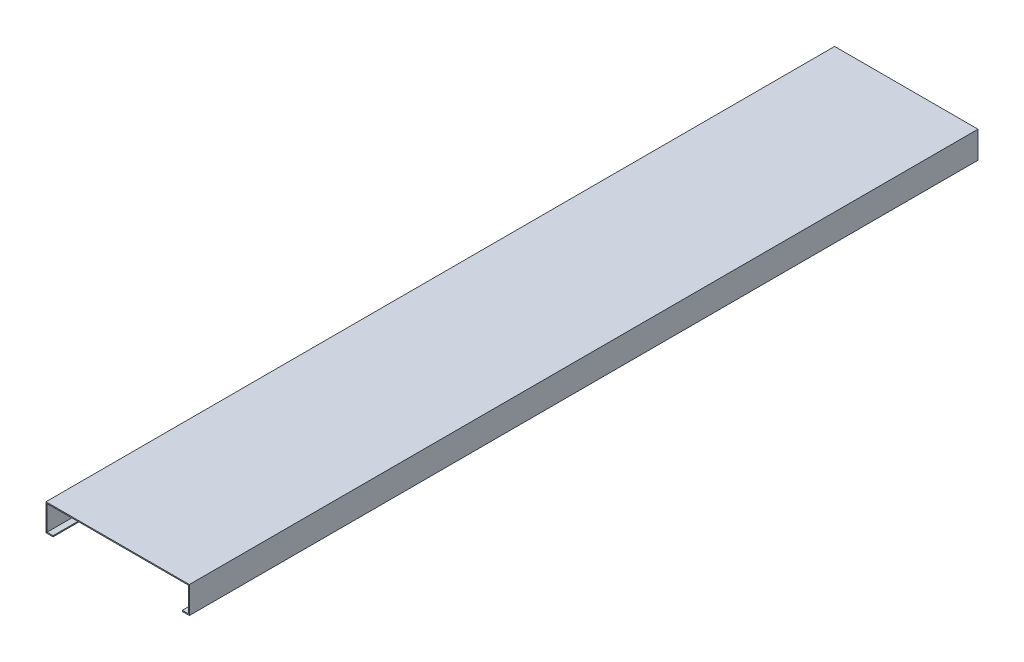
SolidWorks part; units mm, degrees
ref_plane "Alzado" through (0, 0, 0) normal (0, 0, 1) x (1, 0, 0)
ref_plane "Planta" through (0, 0, 0) normal (0, 1, 0) x (1, 0, 0)
ref_plane "Vista lateral" through (0, 0, 0) normal (1, 0, 0) x (0, 0, -1)
sketch "Croquis1" plane through (0, 0, 0) normal (0, 0, 1) x (1, 0, 0)
  line L0 (0, 0) -> (202.5, 0)
  line L1 (202.5, 0) -> (202.5, -38)
  line L2 (202.5, -38) -> (192.5, -38)
  line L3 (192.5, -38) -> (192.5, -36.5)
  line L4 (192.5, -36.5) -> (201, -36.5)
  line L5 (201, -36.5) -> (201, -1.5)
  line L6 (201, -1.5) -> (1.5, -1.5)
  line L7 (0, 0) -> (0, -38)
  line L8 (0, -38) -> (10, -38)
  line L9 (10, -38) -> (10, -36.5)
  line L10 (10, -36.5) -> (1.5, -36.5)
  line L11 (1.5, -36.5) -> (1.5, -1.5)
  dimension "D1" = 38
  dimension "D2" = 10
  dimension "D3" = 1.5
  dimension "D4" = 8.5
  dimension "D5" = 35
  dimension "D6" = 199.5
  dimension "D7" = 38
  dimension "D8" = 10
  dimension "D9" = 1.5
extrude "Saliente-Extruir1" add sketch "Croquis1" along normal blind 1114
